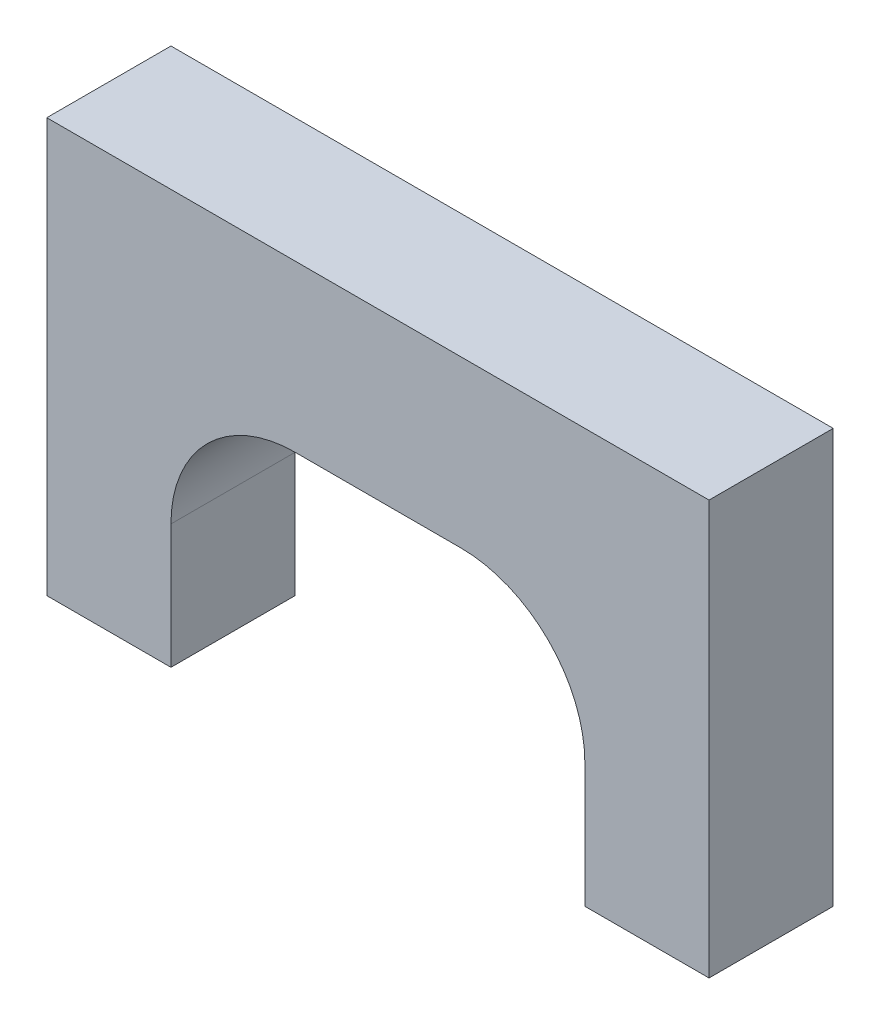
SolidWorks part; units mm, degrees
ref_plane "前视基准面" through (0, 0, 0) normal (0, 0, 1) x (1, 0, 0)
ref_plane "上视基准面" through (0, 0, 0) normal (0, 1, 0) x (1, 0, 0)
ref_plane "右视基准面" through (0, 0, 0) normal (1, 0, 0) x (0, 0, -1)
sketch "草图1" plane through (0, 0, 0) normal (0, 0, 1) x (1, 0, 0)
  line L1 (-8, 5) -> (8, 5)
  line L2 (-8, 5) -> (-8, -5)
  line L3 (-8, -5) -> (8, -5)
  line L4 (8, 5) -> (8, -5)
  line L5 (-8, 5) -> (8, -5) construction
  line L6 (-8, -5) -> (8, 5) construction
  point P0 (0, 0)
  dimension "D1" = 10
  dimension "D2" = 16
extrude "凸台-拉伸1" add sketch "草图1" along normal blind 3
sketch "草图2" plane through (0, 0, 3) normal (0, 0, 1) x (1, 0, 0)
  line L0 (-8, -5) -> (8, -5) construction
  line L1 (-5, -11) -> (5, -11)
  line L2 (-5, -11) -> (-5, 1)
  line L3 (-5, 1) -> (5, 1)
  line L4 (5, -11) -> (5, 1)
  line L5 (-5, -11) -> (5, 1) construction
  line L6 (-5, 1) -> (5, -11) construction
  point P0 (0, -5)
  dimension "D1" = 10
  dimension "D2" = 6
extrude "切除-拉伸1" cut sketch "草图2" against normal blind 3
fillet "圆角1" radius 3 2 edges at (-5, 1, 1.5) (5, 1, 1.5)
